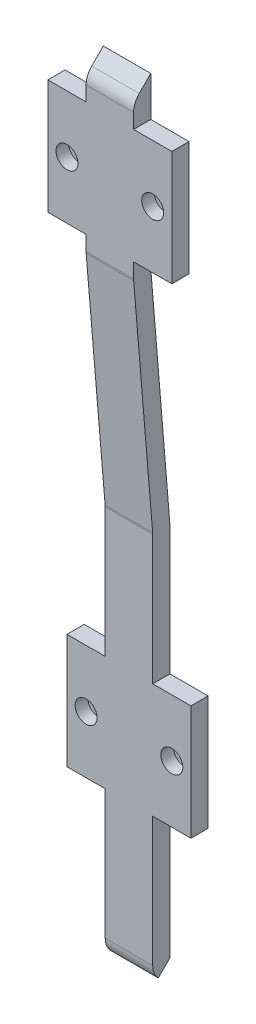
SolidWorks part; units mm, degrees
ref_plane "Alzado" through (0, 0, 0) normal (0, 0, 1) x (1, 0, 0)
ref_plane "Planta" through (0, 0, 0) normal (0, 1, 0) x (1, 0, 0)
ref_plane "Vista lateral" through (0, 0, 0) normal (1, 0, 0) x (0, 0, -1)
sketch "Croquis1" plane through (0, 0, 0) normal (0, 0, 1) x (1, 0, 0)
  line L6 (21.9782, 96.9107) -> (21.9782, 126.9107)
  line L7 (11.9782, 96.9107) -> (21.9782, 96.9107)
  line L8 (-10.4531, 96.9107) -> (-0.4531, 96.9107)
  line L9 (-10.4531, 126.9107) -> (-10.4531, 96.9107)
  line L10 (21.9782, 126.9107) -> (11.9782, 126.9107)
  line L11 (-0.4531, 126.9107) -> (-10.4531, 126.9107)
  line L13 (-0.4531, 130.7712) -> (11.9782, 130.7712)
  line L18 (-0.4531, 96.9107) -> (-0.4531, 93.0502)
  line L19 (11.9782, 96.9107) -> (11.9782, 93.0502)
  line L20 (11.9782, 130.7712) -> (11.9782, 126.9107)
  line L21 (-0.4531, 130.7712) -> (-0.4531, 126.9107)
  line L22 (11.9782, 93.0502) -> (-0.4531, 93.0502)
extrude "Saliente-Extruir1" add sketch "Croquis1" against normal blind 5
sketch "Croquis2" plane through (11.9782, 0, 0) normal (1, 0, 0) x (0, 0, -1)
  line L0 (5, 130.7712) -> (5, 137.8423)
  line L2 (0, 130.7712) -> (5, 130.7712)
  line L6 (5, 137.8423) -> (1.4645, 134.3067)
  line L7 (0.0173, 92.635) -> (4.9827, 33.0495)
  line L8 (5, 32.6343) -> (5, -65.0867)
  line L9 (5, 93.0502) -> (10, 32.6343)
  line L10 (10, 32.6343) -> (10, -65.0867)
  line L11 (10, -65.0867) -> (6.4645, -68.6222)
  line L12 (0, 93.0502) -> (5, 93.0502)
  arc A1 (1.4645, 134.3067) -> (0, 130.7712) centre (5, 130.7712) ccw
  arc A3 (0, 93.0502) -> (0.0173, 92.635) centre (5, 93.0502) ccw
  arc A5 (5, 32.6343) -> (4.9827, 33.0495) centre (0, 32.6343) ccw
  arc A7 (5, -65.0867) -> (6.4645, -68.6222) centre (10, -65.0867) ccw
extrude "Saliente-Extruir2" add sketch "Croquis2" against normal up to surface (12.4313 mm away)
sketch "Croquis3" plane through (0, 0, -5) normal (0, 0, 1) x (1, 0, 0)
  line L6 (11.9782, -31.2262) -> (21.9782, -31.2262)
  line L7 (21.9782, -31.2262) -> (21.9782, -1.2262)
  line L8 (21.9782, -1.2262) -> (11.9782, -1.2262)
  line L9 (-10.4531, -31.2262) -> (-0.4531, -31.2262)
  line L10 (-10.4531, -1.2262) -> (-10.4531, -31.2262)
  line L11 (-0.4531, -1.2262) -> (-10.4531, -1.2262)
  line L12 (-0.4531, -1.2262) -> (-0.4531, -31.2262)
  line L13 (11.9782, -31.2262) -> (11.9782, -1.2262)
extrude "Saliente-Extruir3" add sketch "Croquis3" against normal up to surface (5 mm away)
ref_plane "Plano1" through (5.7626, 0, 0) normal (1, 0, 0) x (0, 0, -1)
sketch "Croquis4" plane through (0, 0, 0) normal (0, 0, 1) x (1, 0, 0)
  line L0 (-5.4531, 126.9107) -> (-5.4531, 96.9107) construction
  line L1 (-0.4531, 126.9107) -> (-10.4531, 126.9107) construction
  line L2 (-10.4531, 96.9107) -> (-0.4531, 96.9107) construction
  line L3 (-5.4531, 96.9107) -> (16.9782, 126.9107) construction
  line L4 (21.9782, 126.9107) -> (11.9782, 126.9107) construction
  line L5 (16.9782, 126.9107) -> (16.9782, 96.9107) construction
  line L6 (11.9782, 96.9107) -> (21.9782, 96.9107) construction
  line L7 (16.9782, 96.9107) -> (16.9782, -1.2262) construction
  line L8 (21.9782, -1.2262) -> (11.9782, -1.2262) construction
  line L9 (16.9782, -1.2262) -> (16.9782, -31.2262) construction
  line L10 (11.9782, -31.2262) -> (21.9782, -31.2262) construction
  line L11 (16.9782, -31.2262) -> (-5.4531, -1.2262) construction
  line L12 (-0.4531, -1.2262) -> (-10.4531, -1.2262) construction
  line L13 (-5.4531, -1.2262) -> (-5.4531, -31.2262) construction
  line L14 (-10.4531, -31.2262) -> (-0.4531, -31.2262) construction
  circle A0 centre (-5.4531, 111.9107) radius 1.55
  circle A1 centre (16.9782, 111.9107) radius 1.55
  circle A2 centre (-5.4531, -16.2262) radius 1.55
  circle A3 centre (16.9782, -16.2262) radius 1.55
  dimension "D1" = 3.1
extrude "Cortar-Extruir1" cut sketch "Croquis4" against normal through all
sketch "Croquis5" plane through (0, 0, -5) normal (0, 0, 1) x (1, 0, 0)
  circle A0 centre (-5.4531, -16.2262) radius 2.875
  circle A1 centre (16.9782, -16.2262) radius 2.875
  dimension "D1" = 5.75
extrude "Cortar-Extruir2" cut sketch "Croquis5" against normal blind 3.3
sketch "Croquis6" plane through (0, 0, 0) normal (0, 0, 1) x (1, 0, 0)
  circle A0 centre (-5.4531, 111.9107) radius 2.875
  circle A1 centre (16.9782, 111.9107) radius 2.875
  circle A2 centre (-5.4531, -16.2262) radius 2.875 construction
extrude "Cortar-Extruir3" cut sketch "Croquis6" against normal blind 3.3
sketch "Croquis7" plane through (21.9782, 0, 0) normal (1, 0, 0) x (0, 0, -1)
  line L29 (9.5, -65.0867) -> (9.5, -65.5867)
  line L30 (6.4645, -68.6222) -> (10, -65.0867) construction
  line L31 (9.5, -65.5867) -> (10, -65.0867)
  line L32 (5, 126.9107) -> (5, 137.8423) construction
  line L33 (5, 96.9107) -> (5, 126.9107) construction
  line L34 (10, 32.6343) -> (5, 93.0502) construction
  line L35 (10, -1.2262) -> (10, 32.6343) construction
  line L36 (4.5, 126.9107) -> (4.5, 137.8423)
  line L37 (4.5, 96.9107) -> (4.5, 126.9107)
  line L38 (4.5, 93.0296) -> (4.5, 96.9107)
  line L39 (9.5, 32.6136) -> (4.5, 93.0296)
  line L40 (9.5, -1.2262) -> (9.5, 32.6136)
  line L41 (9.5, -31.2262) -> (9.5, -1.2262)
  line L42 (9.5, -65.0867) -> (9.5, -31.2262)
  line L43 (4.5, 126.9107) -> (4.5, 137.8423)
  line L44 (4.5, 96.9107) -> (4.5, 126.9107)
  line L45 (4.5, 93.0296) -> (4.5, 96.9107)
  line L46 (9.5, 32.6136) -> (4.5, 93.0296)
  line L47 (9.5, -1.2262) -> (9.5, 32.6136)
  line L48 (9.5, -31.2262) -> (9.5, -1.2262)
  line L49 (9.5, -65.0867) -> (9.5, -31.2262)
  line L50 (10, -31.2262) -> (10, -1.2262) construction
  line L51 (10, -65.0867) -> (10, -31.2262) construction
  line L52 (5, 126.9107) -> (5, 137.8423)
  line L53 (5, 96.9107) -> (5, 126.9107)
  line L54 (10, 32.6343) -> (5, 93.0502)
  line L55 (10, -1.2262) -> (10, 32.6343)
  line L56 (10, -31.2262) -> (10, -1.2262)
  line L57 (10, -65.0867) -> (10, -31.2262)
  line L58 (5, 137.8423) -> (4.5, 137.8423)
  line L59 (5, 93.0502) -> (5, 96.9107) construction
  line L60 (5, 93.0502) -> (5, 96.9107)
  dimension "D1" = 0.5
extrude "Cortar-Extruir4" cut sketch "Croquis7" against normal through all
